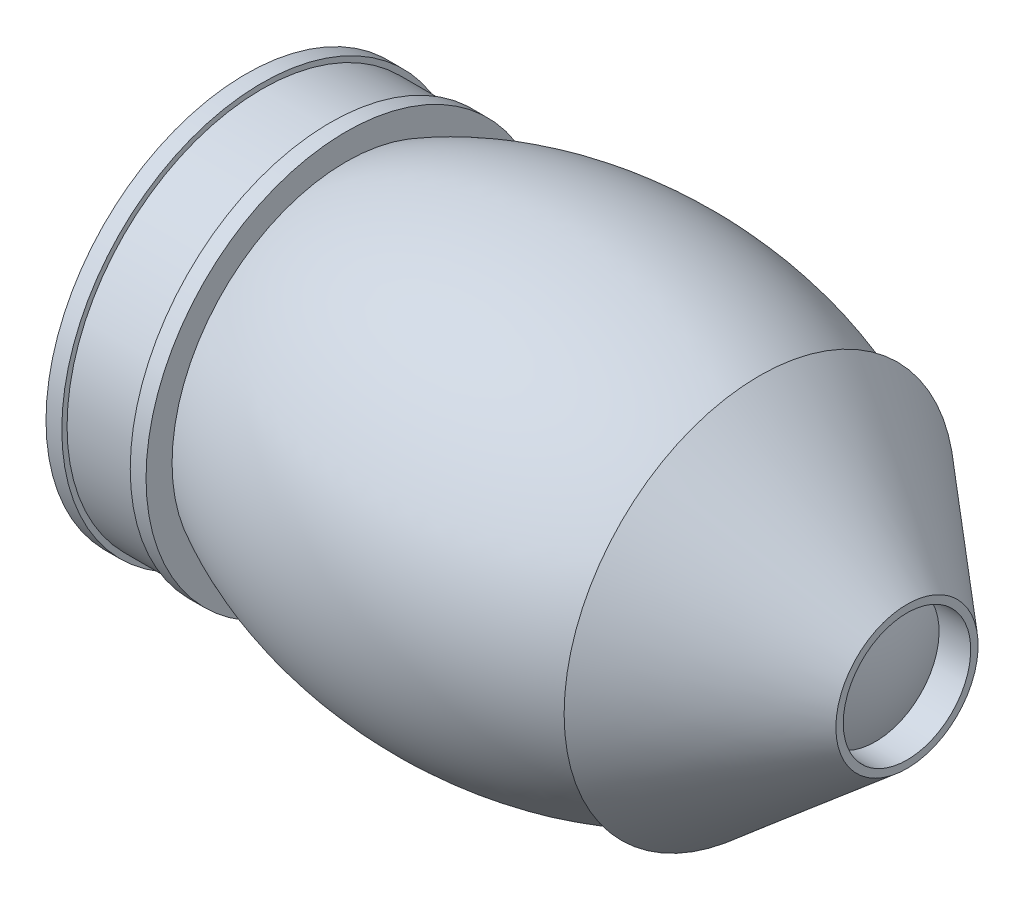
SolidWorks part; units mm, degrees
ref_plane "Front Plane" through (0, 0, 0) normal (0, 0, 1) x (1, 0, 0)
ref_plane "Top Plane" through (0, 0, 0) normal (0, 1, 0) x (1, 0, 0)
ref_plane "Right Plane" through (0, 0, 0) normal (1, 0, 0) x (0, 0, -1)
sketch "layout" plane through (0, 0, 0) normal (0, 0, 1) x (1, 0, 0)
  line L0 (0, 72.8645) -> (0, -75.9279)
  line L1 (-24.507, 51.8585) -> (-80.0854, 25.4872)
  line L2 (-24.507, -51.8585) -> (-80.0854, -25.4872)
  line L3 (-181.6143, 0) -> (272.2027, 0) construction
  line L4 (-80.0854, 25.4872) -> (-80.0854, -25.4872)
  line L5 (-24.507, 72.8645) -> (-24.507, -75.9279)
  line L6 (0, -25.4872) -> (72.6457, -78.5537)
  line L7 (0, 15.5357) -> (119.2298, -71.5597)
  line L8 (5.6891, 55.3595) -> (149.8845, -49.9727)
  line L9 (59.6149, 68.4883) -> (169.2448, -11.5945)
  line L10 (9.6277, -63.5) -> (129.0993, 55.3595)
  line L11 (55.5784, -75.9279) -> (160.4906, 28.4469)
  line L12 (0, -13.122) -> (82.0305, 68.4883)
  line L13 (0, 31.2902) -> (46.9503, 78)
  line L14 (129.0993, 51.8585) -> (129.0993, -51.8585)
  line L15 (129.0993, -51.8585) -> (147.042, -41.259)
  line L16 (147.042, -41.259) -> (147.042, 41.259)
  line L17 (147.042, 41.259) -> (129.0993, 51.8585)
  line L18 (-44.7559, 42.2506) -> (-27.1911, -50.5849)
  line L19 (-70.3187, 30.1213) -> (-57.7964, -36.0631)
  arc A0 (147.042, 34.7912) -> (164.9846, 55.3595) centre (127.6936, 69.7797) ccw
  arc A1 (147.042, 20.0085) -> (164.9846, 55.3595) centre (126.2417, 52.7948) ccw
  arc A2 (147.042, -20.0085) -> (164.9846, -55.3595) centre (126.2417, -52.7948) cw
  arc A3 (147.042, -34.7912) -> (164.9846, -55.3595) centre (127.6936, -69.7797) cw
  arc A4 (177.6757, 25.4872) -> (190.0383, 6.4422) centre (181.4271, 14.3874) cw
  arc A5 (190.0383, 6.4422) -> (212.5513, 0) centre (197.9301, -8.5375) cw
  arc A6 (190.0383, -6.4422) -> (212.5513, 0) centre (197.9301, 8.5375) ccw
  arc A7 (177.6757, -25.4872) -> (190.0383, -6.4422) centre (181.4271, -14.3874) ccw
  ellipse E0 centre (63.5, 0) end of major axis (-31.75, 0) minor radius 63.5
  spline S0 degree 3 poles (-19.2555, 63.5) (-17.4426, 65.895) (-13.4004, 71.2351) (-3.8421, 61.1456) (-5.6575, 46.6863) (-22.1801, 41.9027) (-21.6925, 25.1991) (-7.1944, 9.6527) (-2.088, 26.5071) (-6.5362, 32.0363) (-8.7525, 34.7912) knots 0 0 0 0 0.078911 0.175946 0.318094 0.467808 0.619611 0.780725 0.890747 1 1 1 1
  spline S1 degree 3 poles (-19.1604, 21.147) (-17.3475, 23.542) (-13.3053, 28.882) (-3.747, 18.7926) (-5.5623, 4.3333) (-22.085, -0.4503) (-21.5974, -17.154) (-7.0992, -32.7003) (-1.9929, -15.846) (-6.4411, -10.3167) (-8.6574, -7.5618) knots 0 0 0 0 0.078911 0.175946 0.318094 0.467808 0.619611 0.780725 0.890747 1 1 1 1
  spline S2 degree 3 poles (-19.1604, -17.8016) (-17.3475, -15.4066) (-13.3053, -10.0666) (-3.747, -20.156) (-5.5623, -34.6154) (-22.085, -39.399) (-21.5974, -56.1026) (-7.0992, -71.6489) (-1.9929, -54.7946) (-6.4411, -49.2654) (-8.6574, -46.5105) knots 0 0 0 0 0.078911 0.175946 0.318094 0.467808 0.619611 0.780725 0.890747 1 1 1 1
  spline S3 degree 3 poles (164.9846, 34.7912) (163.4358, 35.2072) (158.2445, 36.6018) (159.3414, 24.8306) (166.1705, 19.5024) (174.0785, 8.5709) (183.4666, 19.6788) (179.3793, 23.7784) (177.6757, 25.4872) knots 0 0 0 0 0.084111 0.281928 0.425819 0.683243 0.867972 1 1 1 1
  spline S4 degree 3 poles (164.9846, -34.7912) (163.4358, -35.2072) (158.2445, -36.6018) (159.3414, -24.8306) (166.1705, -19.5024) (174.0785, -8.5709) (183.4666, -19.6788) (179.3793, -23.7784) (177.6757, -25.4872) knots 0 0 0 0 0.084111 0.281928 0.425819 0.683243 0.867972 1 1 1 1
  dimension "D1" = 127
  dimension "D2" = 63.5
  dimension "D3" = 190.5
sketch "Sketch2" plane through (0, 0, 0) normal (0, 0, 1) x (1, 0, 0)
  line L0 (-100.8728, 0) -> (272.2027, 0) construction
  line L1 (-181.6143, 0) -> (272.2027, 0) construction
  line L2 (-31.75, 0) -> (158.75, 0)
  ellipse E0 centre (63.5, 0) end of major axis (-31.75, 0) minor radius 63.5 construction
  ellipse E1 centre (63.5, 0) end of major axis (-31.75, 0) minor radius 63.5 (158.75, 0) -> (-31.75, 0) ccw
revolve "Revolve1" add sketch "Sketch2" angle 360 about L0
sketch "Sketch3" plane through (0, 0, 0) normal (0, 0, 1) x (1, 0, 0)
  line L0 (3.993, 0) -> (3.993, 57)
  line L1 (-24.507, 0) -> (3.993, 0)
  line L2 (3.993, 57) -> (-0.507, 57)
  line L3 (-0.507, 57) -> (-0.507, 55.5)
  line L4 (-0.507, 55.5) -> (-20.007, 55.5)
  line L5 (-20.007, 55.5) -> (-20.007, 57)
  line L6 (-20.007, 57) -> (-24.507, 57)
  line L7 (-24.507, 72.8645) -> (-24.507, -75.9279) construction
  line L8 (-24.507, 57) -> (-24.507, 0)
  line L10 (-41.403, 0) -> (197.2662, 0) construction
  line L11 (-181.6143, 0) -> (272.2027, 0) construction
  line L13 (-100.8728, 0) -> (272.2027, 0) construction
  line L14 (118.939, 50.6568) -> (121.7488, 55.6432)
  line L15 (121.7488, 55.6432) -> (163.7892, 20.2678)
  line L16 (163.7892, 20.2678) -> (163.7892, 18.1541)
  line L17 (163.7892, 18.1541) -> (118.939, 18.1541)
  line L18 (118.939, 18.1541) -> (118.939, 50.6568)
  dimension "D1" = 4.5
  dimension "D2" = 1.5
  dimension "D3" = 57
  dimension "D4" = 28.5
  dimension "D5" = 36.3082
  dimension "D6" = 111.2864
  dimension "D7" = 44.8502
  dimension "D8" = 188.2962
  dimension "D9" = 40.5356
  dimension "D10" = 101.3136
  dimension "D11" = 100.679
revolve "Revolve2" add sketch "Sketch3" angle 360 about L10
sketch "Wrap_Sketch1" plane through (0, 0, 0) normal (0, 1, 0) x (1, 0, 0)
  line L0 (-11.0443, -9.1821) -> (-14.7739, -5.5355)
  spline S0 degree 3 poles (-9.35, -10.7474) (-9.237, -9.1245) (-9.0104, -5.869) (-5.5299, -2.5555) (-1.6233, -3.3249) (-1.2092, -6.4903) (-3.1925, -7.5279) (-5.5674, -8.2642) (-5.8113, -12.2242) (-6.3714, -16.3868) (-8.85, -22.0862) (-17.1719, -22.3367) (-19.525, -15.1802) (-18.9807, -9.9705) (-14.8782, -5.59) (-14.7739, -5.5355) knots 0 0 0 0 0.08528 0.171071 0.219275 0.263893 0.29902 0.328578 0.38968 0.47591 0.571146 0.686745 0.817502 0.898821 1 1 1 1
  spline S2 degree 3 poles (-9.35, -10.7474) (-9.9728, -10.5315) (-11.47, -10.0125) (-14.196, -11.4073) (-14.5713, -13.429) (-14.7739, -14.5205) knots 0 0 0 0 0.246847 0.593412 1 1 1 1
  spline S3 degree 3 poles (-14.7739, -14.5205) (-11.0883, -13.5422) (-9.8205, -18.1793) (-14.1536, -19.1569) (-17.1975, -16.7211) (-17.2755, -11.9895) (-14.6736, -9.3886) (-11.1415, -9.1746) (-11.0443, -9.1821) knots 0 0 0 0 0.220333 0.34622 0.48562 0.703249 0.886335 1.002407 1.002407 1.002407 1.002407
  spline S5 degree 3 poles (-9.35, -10.7474) (-9.4099, -10.4501) (-9.4699, -10.1538) (-9.5294, -9.8586) knots 0.443908 0.443908 0.443908 0.443908 0.459322 0.459322 0.459322 0.459322 construction
sketch "Wrap_Sketch2" plane through (0, 0, 0) normal (0, 1, 0) x (1, 0, 0)
  spline S0 degree 3 poles (-12.2883, -32.1617) (-12.3895, -31.8456) (-8.6599, -24.5693) (-3.9115, -21.8188) (-3.501, -16.2354) (-8.7487, -11.1709) (-15.5504, -6.2257) (-19.5749, 2.3867) (-18.5523, 9.3749) (-14.6889, 11.7261) (-14.8869, 14.4805) (-16.0881, 15.3934) (-16.7674, 15.9097) knots 0 0 0 0 0.140743 0.247194 0.30594 0.398391 0.603347 0.745282 0.875632 0.924478 0.957295 1 1 1 1
  spline S1 degree 3 poles (-16.7674, 15.9097) (-16.2521, 16.3072) (-14.833, 17.402) (-12.2909, 15.746) (-11.4068, 14.2327) (-11.0491, 13.6204) knots 0 0 0 0 0.253396 0.697898 1 1 1 1
  spline S2 degree 3 poles (-11.0491, 13.6204) (-10.5758, 13.6387) (0.2311, 11.3427) (-2.288, 2.3683) (-7.4317, -0.1186) (-11.4342, 2.1394) (-11.8448, 6.1447) (-9.3578, 7.2633) (-8.0178, 6.2207) (-7.2615, 7.1809) (-7.9694, 8.5384) (-10.0368, 9.602) (-13.1914, 8.9981) (-15.6509, 5.5881) (-15.4444, -0.1902) (-11.3186, -5.5093) (-6.3881, -9.9295) (-0.75, -14.2869) (-0.7568, -22.9581) (-6.5979, -26.2613) (-12.1881, -31.9161) (-12.2883, -32.1617) knots 0 0 0 0 0.106368 0.187074 0.232936 0.280465 0.316952 0.339912 0.353588 0.361976 0.371353 0.399607 0.434448 0.468338 0.530958 0.611626 0.684818 0.75444 0.841452 0.912711 1 1 1 1
